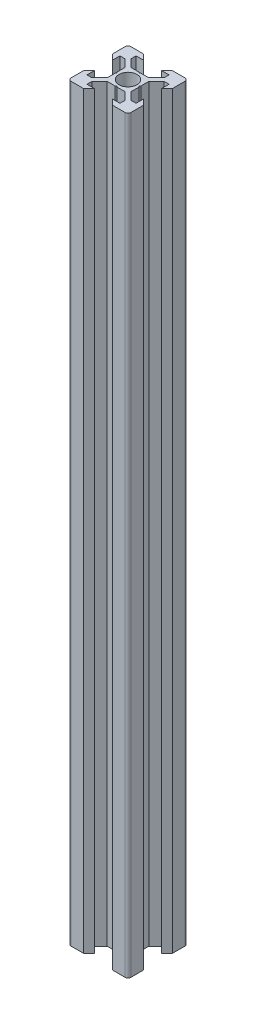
SolidWorks part; units mm, degrees
ref_plane "Front Plane" through (0, 0, 0) normal (0, 0, 1) x (1, 0, 0)
ref_plane "Top Plane" through (0, 0, 0) normal (0, 1, 0) x (1, 0, 0)
ref_plane "Right Plane" through (0, 0, 0) normal (1, 0, 0) x (0, 0, -1)
sketch "Sketch1" plane through (0, 0, 0) normal (0, 1, 0) x (1, 0, 0)
  line L0 (9.9996, -8.9996) -> (9.9996, -4.7998)
  line L1 (9.9996, -4.7998) -> (8.1997, -2.9999)
  line L2 (8.1997, -2.9999) -> (8.1997, -5.4998)
  line L3 (8.1997, -5.4998) -> (6.5604, -5.4998)
  line L4 (6.5604, -5.4998) -> (3.9998, -2.9392)
  line L5 (3.9998, -2.9392) -> (3.9998, -0.3)
  line L6 (3.9998, -0.3) -> (3.6999, 0)
  line L7 (3.6999, 0) -> (3.9998, 0.3)
  line L8 (3.9998, 0.3) -> (3.9998, 2.9392)
  line L9 (3.9998, 2.9392) -> (6.5604, 5.4998)
  line L10 (6.5604, 5.4998) -> (8.1997, 5.4998)
  line L11 (8.1997, 5.4998) -> (8.1997, 2.9999)
  line L12 (8.1997, 2.9999) -> (9.9996, 4.7998)
  line L13 (9.9996, 4.7998) -> (9.9996, 8.9996)
  line L14 (8.9996, 9.9996) -> (4.7998, 9.9996)
  line L15 (4.7998, 9.9996) -> (2.9999, 8.1997)
  line L16 (2.9999, 8.1997) -> (5.4998, 8.1997)
  line L17 (5.4998, 8.1997) -> (5.4998, 6.5604)
  line L18 (5.4998, 6.5604) -> (2.9392, 3.9998)
  line L19 (2.9392, 3.9998) -> (0.3, 3.9998)
  line L20 (0.3, 3.9998) -> (0, 3.6999)
  line L21 (0, 3.6999) -> (-0.3, 3.9998)
  line L22 (-0.3, 3.9998) -> (-2.9392, 3.9998)
  line L23 (-2.9392, 3.9998) -> (-5.4998, 6.5604)
  line L24 (-5.4998, 6.5604) -> (-5.4998, 8.1997)
  line L25 (-5.4998, 8.1997) -> (-2.9999, 8.1997)
  line L26 (-2.9999, 8.1997) -> (-4.7998, 9.9996)
  line L27 (-4.7998, 9.9996) -> (-8.9996, 9.9996)
  line L28 (-9.9996, 8.9996) -> (-9.9996, 4.7998)
  line L29 (-9.9996, 4.7998) -> (-8.1997, 2.9999)
  line L30 (-8.1997, 2.9999) -> (-8.1997, 5.4998)
  line L31 (-8.1997, 5.4998) -> (-6.5604, 5.4998)
  line L32 (-6.5604, 5.4998) -> (-3.9998, 2.9392)
  line L33 (-3.9998, 2.9392) -> (-3.9998, 0.3)
  line L34 (-3.9998, 0.3) -> (-3.6999, 0)
  line L35 (-3.6999, 0) -> (-3.9998, -0.3)
  line L36 (-3.9998, -0.3) -> (-3.9998, -2.9392)
  line L37 (-3.9998, -2.9392) -> (-6.5604, -5.4998)
  line L38 (-6.5604, -5.4998) -> (-8.1997, -5.4998)
  line L39 (-8.1997, -5.4998) -> (-8.1997, -2.9999)
  line L40 (-8.1997, -2.9999) -> (-9.9996, -4.7998)
  line L41 (-9.9996, -4.7998) -> (-9.9996, -8.9996)
  line L42 (-8.9996, -9.9996) -> (-4.7998, -9.9996)
  line L43 (-4.7998, -9.9996) -> (-2.9999, -8.1997)
  line L44 (-2.9999, -8.1997) -> (-5.4998, -8.1997)
  line L45 (-5.4998, -8.1997) -> (-5.4998, -6.5604)
  line L46 (-5.4998, -6.5604) -> (-2.9392, -3.9998)
  line L47 (-2.9392, -3.9998) -> (-0.3, -3.9998)
  line L48 (-0.3, -3.9998) -> (0, -3.6999)
  line L49 (0, -3.6999) -> (0.3, -3.9998)
  line L50 (0.3, -3.9998) -> (2.9392, -3.9998)
  line L51 (2.9392, -3.9998) -> (5.4998, -6.5604)
  line L52 (5.4998, -6.5604) -> (5.4998, -8.1997)
  line L53 (5.4998, -8.1997) -> (2.9999, -8.1997)
  line L54 (2.9999, -8.1997) -> (4.7998, -9.9996)
  line L55 (4.7998, -9.9996) -> (8.9996, -9.9996)
  arc A2 (8.9996, -9.9996) -> (9.9996, -8.9996) centre (8.9996, -8.9996) ccw
  arc A3 (9.9996, 8.9996) -> (8.9996, 9.9996) centre (8.9996, 8.9996) ccw
  arc A4 (-8.9996, 9.9996) -> (-9.9996, 8.9996) centre (-8.9996, 8.9996) ccw
  arc A5 (-9.9996, -8.9996) -> (-8.9996, -9.9996) centre (-8.9996, -8.9996) ccw
  circle A6 centre (0, 0) radius 3
  dimension "D1" = 6
extrude "Boss-Extrude1" add sketch "Sketch1" along normal blind 250
